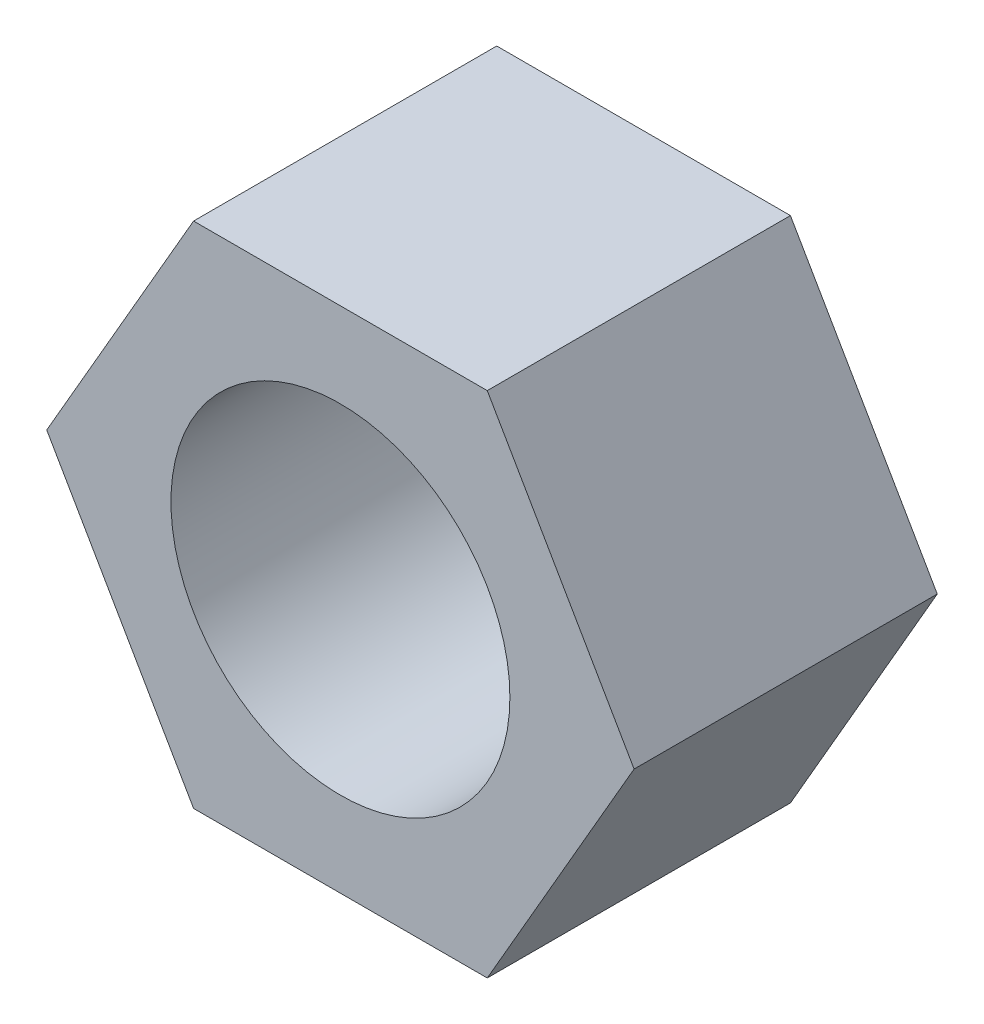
SolidWorks part; units mm, degrees
ref_plane "Front" through (0, 0, 0) normal (0, 0, 1) x (1, 0, 0)
ref_plane "Top" through (0, 0, 0) normal (0, 1, 0) x (1, 0, 0)
ref_plane "Right" through (0, 0, 0) normal (1, 0, 0) x (0, 0, -1)
sketch "Sketch1" plane through (0, 0, 0) normal (0, 0, 1) x (1, 0, 0)
  line L0 (0, 36.9968) -> (0, -40.2525) construction
  line L1 (-50.3157, 0) -> (49.1318, 0) construction
  line L2 (6.8775, 11.9126) -> (-6.8775, 11.9126)
  line L3 (-6.8775, 11.9126) -> (-13.7541, 0)
  line L4 (6.8775, 11.9126) -> (13.7541, 0)
  line L5 (6.8775, -11.9126) -> (13.7541, 0)
  line L6 (-6.8775, -11.9126) -> (-13.7541, 0)
  line L7 (6.8775, -11.9126) -> (-6.8775, -11.9126)
  point P9 (0, 11.9126)
  point P12 (0, -11.9126)
  dimension "D1" = 23.8252
  dimension "D2" = 27.5082
extrude "Extrude1" add sketch "Sketch1" along normal blind 14.1986
sketch "Sketch2" plane through (0, 0, 14.1986) normal (0, 0, 1) x (1, 0, 0)
  circle A0 centre (0, 0) radius 7.9375
  dimension "D1" = 15.875
extrude "Cut-Extrude1" cut sketch "Sketch2" against normal through all
